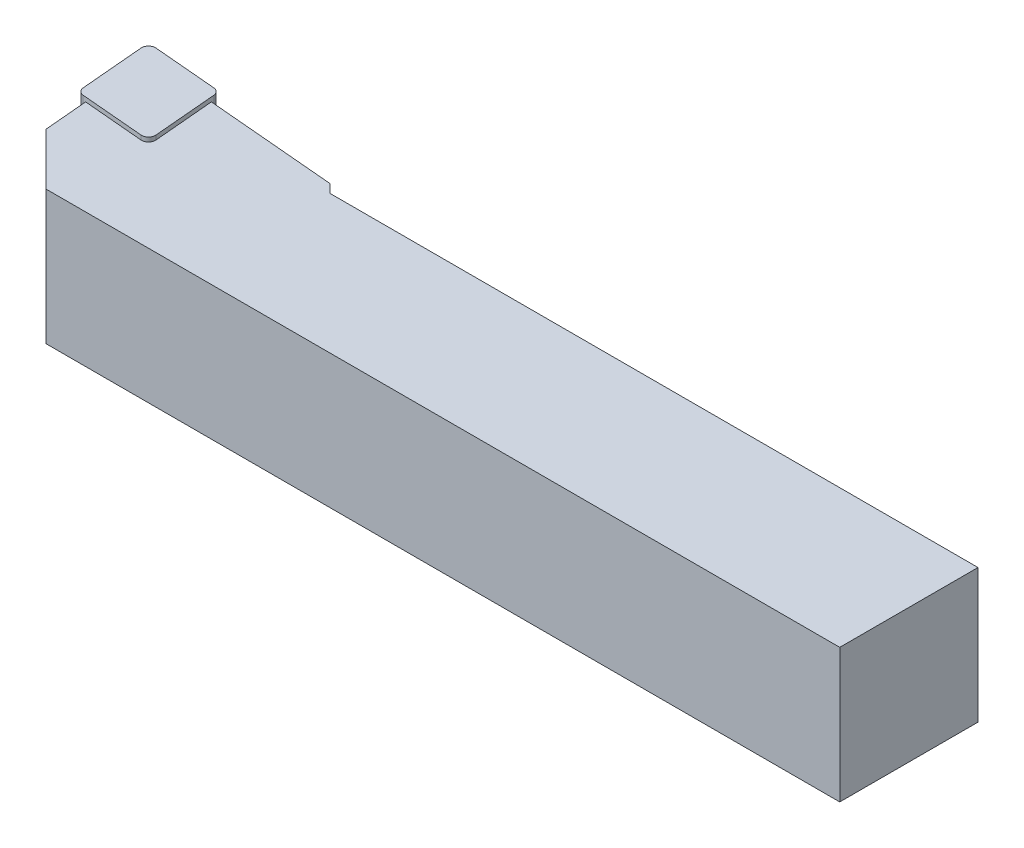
SolidWorks part; units mm, degrees
ref_plane "Plan1" through (0, 0, 0) normal (0, 0, 1) x (1, 0, 0)
ref_plane "Plan2" through (0, 0, 0) normal (0, 1, 0) x (1, 0, 0)
ref_plane "Plan3" through (0, 0, 0) normal (1, 0, 0) x (0, 0, -1)
sketch "EsqPlaquette" plane through (0, 0, 0) normal (0, 1, 0) x (1, 0, 0)
  line L0 (-10, 0) -> (10, 0) construction
  line L1 (0, 7.3661) -> (0, -10.2271) construction
  line L2 (0.6458, -8.217) -> (0.003, -0.8697)
  line L3 (0.8697, -0.003) -> (8.217, -0.6458)
  line L4 (8.9442, -1.3731) -> (9.587, -8.7203)
  line L5 (8.7203, -9.587) -> (1.3731, -8.9442)
  arc A0 (0.8697, -0.003) -> (0.003, -0.8697) centre (0.8, -0.8) ccw
  arc A1 (1.3731, -8.9442) -> (0.6458, -8.217) centre (1.4428, -8.1473) cw
  arc A2 (9.587, -8.7203) -> (8.7203, -9.587) centre (8.7901, -8.7901) cw
  arc A3 (8.217, -0.6458) -> (8.9442, -1.3731) centre (8.1473, -1.4428) cw
  point P11 (-0.0801, 0.0801)
  point P16 (9.6701, -9.6701)
  point P19 (8.8857, -0.7044)
  dimension "D1" = 80
  dimension "RBec" = 0.8
  dimension "D3" = 9
  dimension "D5" = 5
  dimension "LU" = 9
extrude "Plaquette" add sketch "EsqPlaquette" against normal blind 4.76
ref_plane "Plan4" through (0, -0.5, 0) normal (0, 1, 0) x (-1, 0, 0)
sketch "EsqCorps" plane through (0, -0.5, 0) normal (0, 1, 0) x (-1, 0, 0)
  line L0 (0, 0) -> (-28, 0) construction
  line L1 (-100, 4) -> (-100, 20)
  line L3 (-100, 20) -> (-8.1374, 20)
  line L4 (-100, 4) -> (-25, 4)
  line L5 (-1, 1) -> (-24.0134, 3.0134)
  line L6 (-1, 1) -> (-2.1374, 14)
  line L7 (-2.1374, 14) -> (-8.1374, 20)
  line L8 (-25, 4) -> (-24.0134, 3.0134)
  dimension "D1" = 1
  dimension "D2" = 1
  dimension "D3" = 80
  dimension "D4" = 5
  dimension "D5" = 20
  dimension "D6" = 16
  dimension "D7" = 25
  dimension "D8" = 100
  dimension "D9" = 135
  dimension "D10" = 135
  dimension "D11" = 6
extrude "CorpsOutil" add sketch "EsqCorps" against normal blind 15.5
